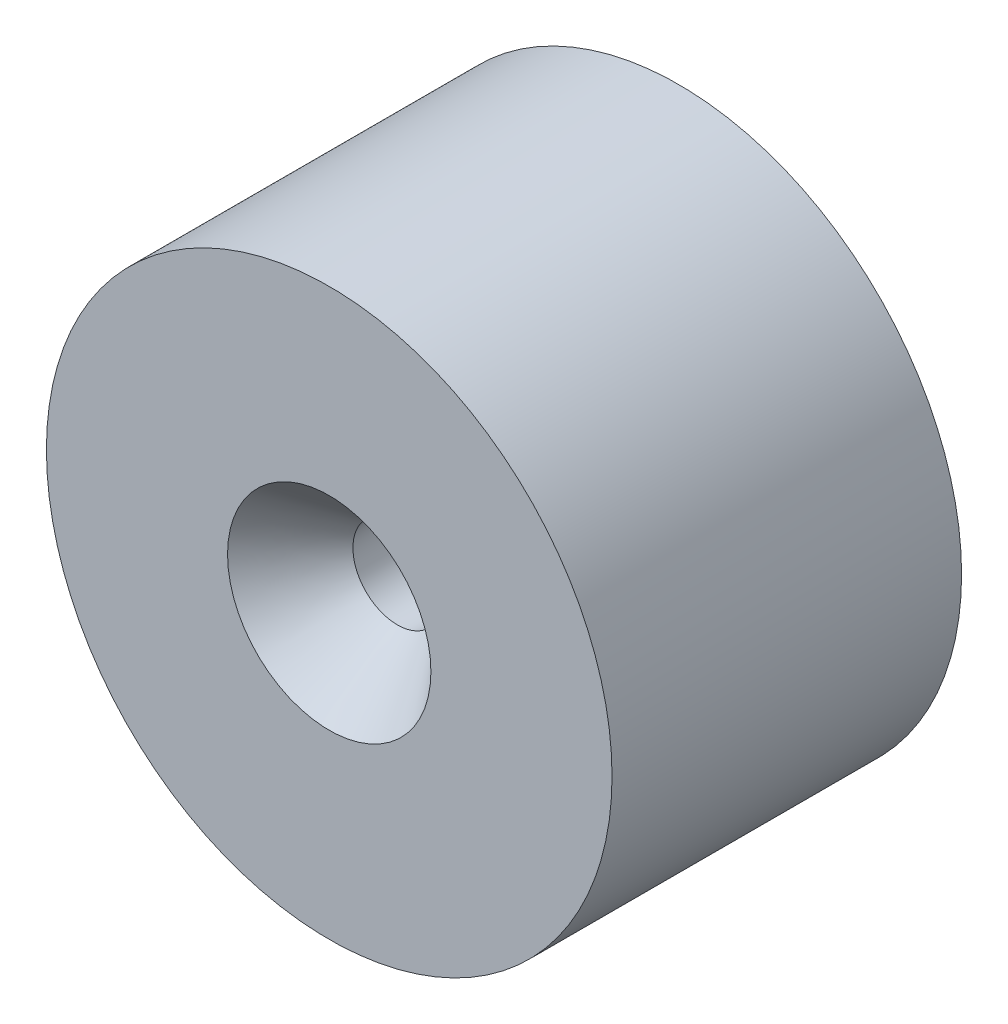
SolidWorks part; units mm, degrees
ref_plane "Front Plane" through (0, 0, 0) normal (0, 0, 1) x (1, 0, 0)
ref_plane "Top Plane" through (0, 0, 0) normal (0, 1, 0) x (1, 0, 0)
ref_plane "Right Plane" through (0, 0, 0) normal (1, 0, 0) x (0, 0, -1)
sketch "Sketch1" plane through (0, 0, 0) normal (0, 0, 1) x (1, 0, 0)
  circle A0 centre (0, 0) radius 1.4
  dimension "D1" = 2.8
extrude "Extrude-Thin1" add sketch "Sketch1" along normal blind 11 thin
ref_plane "Plane1" through (0, 0, 2) normal (0, 0, -1) x (-1, 0, 0)
sketch "Sketch4" plane through (0, 0, 2) normal (0, 0, -1) x (-1, 0, 0)
  circle A0 centre (0, 0) radius 3.5
  circle A1 centre (0, 0) radius 8.9 construction
  circle A2 centre (0, 0) radius 6.3
  dimension "D1" = 7
  dimension "D2" = 2.6
extrude "Cut-Extrude1" cut sketch "Sketch4" against normal blind 7
hole_wizard "CSK for M3 Flat Head Machine Screw1" positions "Sketch2" profile "Sketch3" countersink size "M3" standard "ANSI Metric"
sketch "Sketch2" plane through (0, 0, 11) normal (0, 0, 1) x (1, 0, 0)
  point P0 (0, 0)
sketch "Sketch3" plane through (0, 0, 11) normal (1, 0, 0) x (0, -1, 0)
  line L0 (0, 0) -> (0, 14.8412)
  line L1 (0, 14.8412) -> (1.4, 14)
  line L2 (1.4, 14) -> (1.4, 2.1452)
  line L3 (1.4, 2.1452) -> (3.2, 0)
  line L5 (3.2, 0) -> (0, 0)
  line L6 (-1.4, 2.1452) -> (-3.2, 0) construction
  line L10 (0, 14.8412) -> (-1.4, 14) construction
  line L11 (0, -6.35) -> (0, 107.95) construction
  dimension "Hole Dia." = 2.8
  dimension "Hole Depth" = 14
  dimension "Near C'Sink Dia." = 6.4
  dimension "Near C'Sink Angle" = 80
  dimension "Drill Angle" = 118
